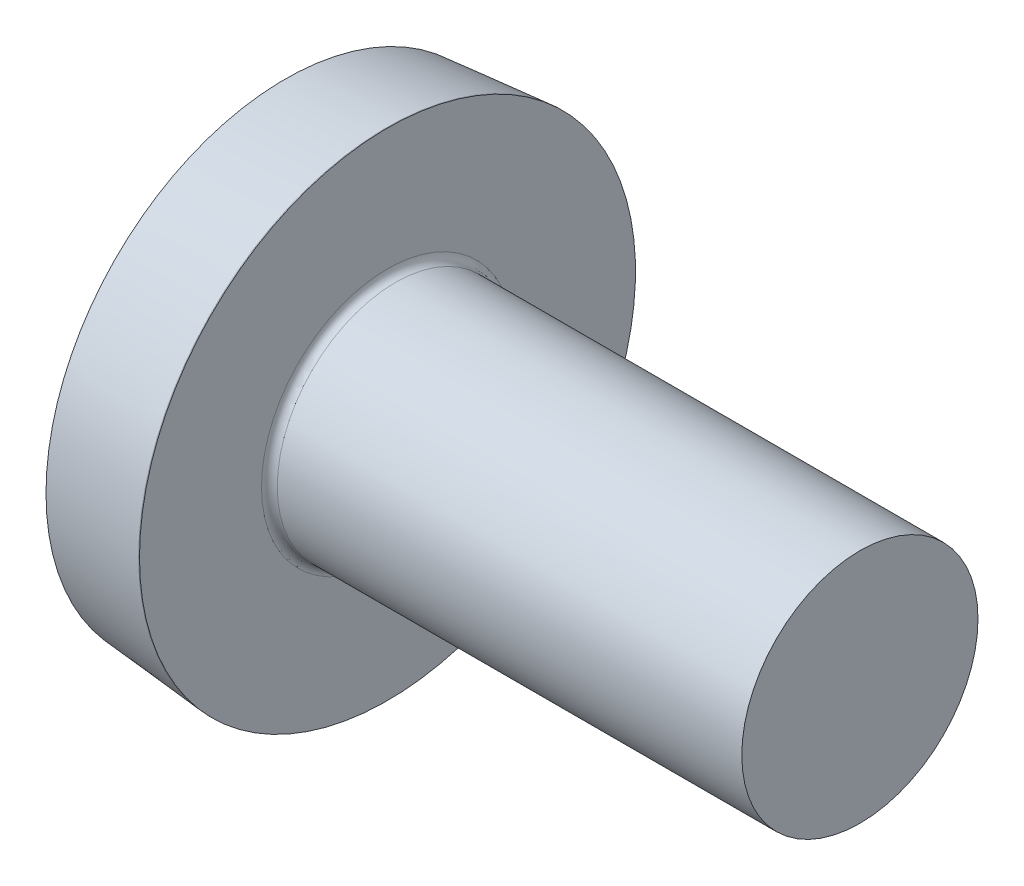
SolidWorks part; units mm, degrees
ref_plane "Plane1" through (0, 0, 0) normal (0, 0, 1) x (1, 0, 0)
ref_plane "Plane2" through (0, 0, 0) normal (0, 1, 0) x (1, 0, 0)
ref_plane "Plane3" through (0, 0, 0) normal (1, 0, 0) x (0, 0, -1)
sketch "BodySke" plane through (0, 0, 0) normal (0, 0, 1) x (1, 0, 0)
  line L0 (1.9, 1.5) -> (1.9, 3.15)
  line L1 (2.4, 6.35) -> (2.4, -3.175) construction
  line L2 (-25.4, 0) -> (127, 0) construction
  line L3 (7.9, 0) -> (0, 0)
  line L4 (1.9, 1.5) -> (7.9, 1.5)
  line L5 (7.9, 1.5) -> (7.9, 0)
  line L6 (0.6, 3.0371) -> (1.89, 3.15)
  line L8 (1.9, 6.35) -> (1.9, -3.175) construction
  line L9 (1.9, 3.15) -> (1.89, 3.15)
  arc A0 (0.6, 3.0371) -> (0, 0) centre (7.9868, 0) ccw
revolve "Base-Revolve" add sketch "BodySke"
fillet "Fillet1" radius 0.1 1 edges at (1.9, 0, 1.5)
sketch "Sketch3" plane through (0, 0, 0) normal (1, 0, 0) x (0, 0, -1)
  line L0 (0.515, -1.85) -> (-0.515, -1.85)
  line L1 (0.515, -1.85) -> (0.515, 1.85)
  line L2 (-0.515, 1.85) -> (0.515, 1.85)
  line L3 (-0.515, 1.85) -> (-0.515, -1.85)
ref_plane "Plane4" through (1.53, 0, 0) normal (1, 0, 0) x (0, 0, -1)
sketch "Sketch4" plane through (1.53, 0, 0) normal (1, 0, 0) x (0, 0, -1)
  line L0 (0.515, -1.0872) -> (-0.515, -1.0872)
  line L1 (0.515, -1.0872) -> (0.515, 1.0872)
  line L2 (-0.515, 1.0872) -> (0.515, 1.0872)
  line L3 (-0.515, 1.0872) -> (-0.515, -1.0872)
loft "Recess" cut profiles "Sketch3", "Sketch4"
pattern_circular "RecPat" count 2 every 90 about axis through (0, 0, 0) along (1, 0, 0) of "Recess"
sketch "RecCorSke" plane through (0, 0, 0) normal (0, 0, 1) x (1, 0, 0)
  line L0 (-3.175, 0) -> (15.875, 0) construction
  line L1 (-25.4, 0) -> (127, 0) construction
  line L2 (0, 0) -> (0, 0.958)
  line L3 (0, 0.958) -> (1.53, 0.851)
  line L4 (1.53, 0.851) -> (1.8065, 0)
  line L5 (1.8065, 0) -> (0, 0)
revolve "RecessCore" cut sketch "RecCorSke" angle 360 about L0
sketch "ThdSchSke" plane through (0, 0, 0) normal (0, 0, 1) x (1, 0, 0)
  line L0 (2.9, -1.2195) -> (2.7036, -1.5)
  line L1 (2.9, -1.2195) -> (3.0964, -1.5)
  line L2 (3.0964, -1.5) -> (3.0964, -1.875)
  line L3 (-3.175, 0) -> (5.1513, 0) construction
  line L5 (3.0964, -1.875) -> (2.7036, -1.875)
  line L6 (2.7036, -1.875) -> (2.7036, -1.5)
revolve "ThreadSchematic" [suppressed] cut sketch "ThdSchSke" angle 360 about L3
pattern_linear "ThdSchPat" [suppressed]
equation "' \"Diameter@BodySke\" = 8"
equation "' \"Length@BodySke\" = 35"
equation "' \"Head_dia@BodySke\" = 16.4"
equation "' \"Oval_ht@BodySke\" = 1.7"
equation "' \"Head_ht@BodySke\" = 4.8"
equation "' \"Thread_nom@BodySke\" =  30"
equation "' \"Thread_nom@BodySke\" = 30"
equation "' \"Head_ang@BodySke\" = 85"
equation "' \"Cross_dia@Sketch3\" = 7.8"
equation "' \"Cross_width@Sketch3\" = 1.42"
equation "' \"Cross_depth@Plane4\" = 4.36"
equation "' \"Diameter@RecCorSke\" = 2.561"
equation "' \"Radius@Fillet1\" = 0.4"
equation "' \"Thread_minor@ThreadCosmetic\" = 6.619"
equation "' \"Advance@BodySke\" = 1.25"
equation "\"D1@Sketch3\" = \"Cross_dia@Sketch3\" / 2"
equation "\"D2@Sketch3\" = \"Cross_width@Sketch3\" / 2"
equation "\"Depth@RecCorSke\" = \"Cross_depth@Plane4\""
equation "\"D1@Sketch4\" = \"Cross_width@Sketch3\""
equation "\"D2@Sketch4\" = \"Cross_dia@Sketch3\" - 2.0 * \"Cross_depth@Plane4\" * tan(26.5  * 0.017453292)"
equation "\"D3@Sketch4\" = \"D1@Sketch4\" / 2"
equation "\"D4@Sketch4\" = \"D2@Sketch4\" / 2"
equation "\"Thread_length@ThreadCosmetic\" = ((sgn( (\"Length@BodySke\" - \"Advance@BodySke\" * 2.0 ) - \"Thread_nom@BodySke\" )-1)*( (\"Length@BodySke\" - \"Advance@BodySke\" * 2.0 ) - \"Thread_nom@BodySke\" ))/-2+ \"Thread_"
equation "\"Thread_minor@ThdSchSke\" = \"Thread_minor@ThreadCosmetic\""
equation "\"Diameter@ThdSchSke\" = \"Diameter@BodySke\""
equation "\"Overcut@ThdSchSke\" = \"Diameter@BodySke\" * 1.25"
equation "\"Start@ThdSchSke\" = \"Head_ht@BodySke\" + \"Length@BodySke\" - \"Thread_length@ThreadCosmetic\"  '---Non-countersunk---"
equation "\"Num_threads@ThdSchPat\" = int( \"Thread_length@ThreadCosmetic\" / \"Advance@BodySke\" + 0.999 )  + 1"
equation "\"Advance@ThdSchPat\" = \"Thread_length@ThreadCosmetic\" /  (\"Num_threads@ThdSchPat\" - 1) 'relax it"
